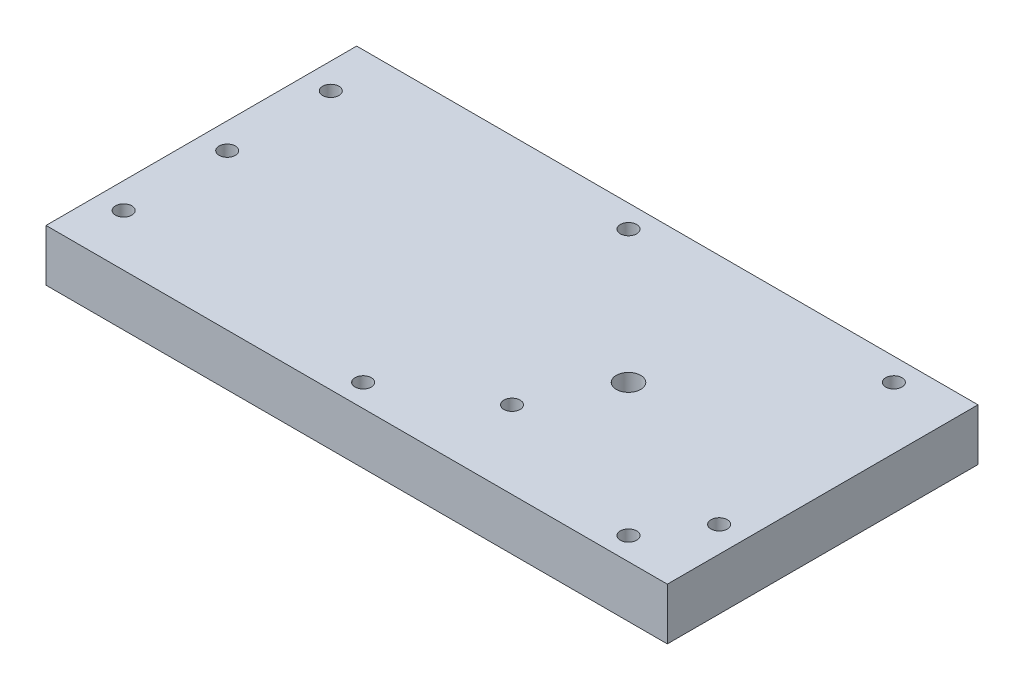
SolidWorks part; units mm, degrees
ref_plane "Front Plane" through (0, 0, 0) normal (0, 0, 1) x (1, 0, 0)
ref_plane "Top Plane" through (0, 0, 0) normal (0, 1, 0) x (1, 0, 0)
ref_plane "Right Plane" through (0, 0, 0) normal (1, 0, 0) x (0, 0, -1)
sketch "Sketch1" plane through (0, 0, 0) normal (0, 1, 0) x (1, 0, 0)
  line L1 (-55.5847, 16.3882) -> (96.8153, 16.3882)
  line L2 (-55.5847, 16.3882) -> (-55.5847, -59.8118)
  line L3 (-55.5847, -59.8118) -> (96.8153, -59.8118)
  line L4 (96.8153, 16.3882) -> (96.8153, -59.8118)
  dimension "D1" = 152.4
  dimension "D2" = 76.2
extrude "Boss-Extrude1" add sketch "Sketch1" along normal blind 12.7
sketch "Sketch2" plane through (0, 12.7, 0) normal (0, 1, 0) x (1, 0, 0)
  line L0 (96.8153, 16.3882) -> (-55.5847, 16.3882) construction
  line L1 (-55.5847, -59.8118) -> (96.8153, -59.8118) construction
  line L2 (-55.5847, 16.3882) -> (-55.5847, -59.8118) construction
  circle A0 centre (-49.2347, 3.6882) radius 2
  circle A1 centre (-49.2347, -21.7118) radius 2
  circle A2 centre (-49.2347, -47.1118) radius 2
  dimension "D7" = 4
  dimension "D8" = 4
  dimension "D9" = 4
  dimension "D1" = 12.7
  dimension "D2" = 38.1
  dimension "D3" = 12.7
  dimension "D4" = 6.35
  dimension "D5" = 6.35
  dimension "D6" = 6.35
extrude "Cut-Extrude1" cut sketch "Sketch2" against normal through all
sketch "Sketch3" plane through (0, 12.7, 0) normal (0, 1, 0) x (1, 0, 0)
  line L0 (96.8153, -59.8118) -> (96.8153, 16.3882) construction
  line L1 (96.8153, 16.3882) -> (-55.5847, 16.3882) construction
  circle A0 centre (49.1903, -21.7118) radius 3
  dimension "D3" = 6
  dimension "D1" = 47.625
  dimension "D2" = 38.1
extrude "Cut-Extrude2" cut sketch "Sketch3" against normal through all
sketch "Sketch4" plane through (0, 12.7, 0) normal (0, 1, 0) x (1, 0, 0)
  line L0 (-55.5847, -59.8118) -> (96.8153, -59.8118) construction
  line L1 (96.8153, -59.8118) -> (96.8153, 16.3882) construction
  circle A0 centre (90.4653, -40.7618) radius 2
  circle A1 centre (39.6653, -40.7618) radius 2
  dimension "D6" = 4
  dimension "D7" = 4
  dimension "D1" = 19.05
  dimension "D2" = 6.35
  dimension "D3" = 19.05
  dimension "D4" = 57.15
extrude "Cut-Extrude3" cut sketch "Sketch4" against normal through all
sketch "Sketch6" plane through (0, 12.7, 0) normal (0, 1, 0) x (-1, 0, 0)
  line L0 (55.5847, 59.8118) -> (-96.8153, 59.8118) construction
  line L1 (-96.8153, -16.3882) -> (55.5847, -16.3882) construction
  line L2 (-96.8153, 59.8118) -> (-96.8153, -16.3882) construction
  circle A0 centre (-16.6466, -10.8319) radius 2
  circle A1 centre (-16.6466, 54.2556) radius 2
  circle A2 centre (-81.7341, 54.2556) radius 2
  circle A3 centre (-81.7341, -10.8319) radius 2
  dimension "D1" = 4
  dimension "D2" = 4
  dimension "D3" = 4
  dimension "D4" = 4
  dimension "D5" = 5.5562
  dimension "D6" = 5.5562
  dimension "D7" = 5.5562
  dimension "D8" = 5.5562
  dimension "D9" = 15.0812
  dimension "D10" = 15.0812
  dimension "D11" = 65.0875
  dimension "D12" = 65.0875
extrude "Cut-Extrude4" cut sketch "Sketch6" against normal blind 6.35
